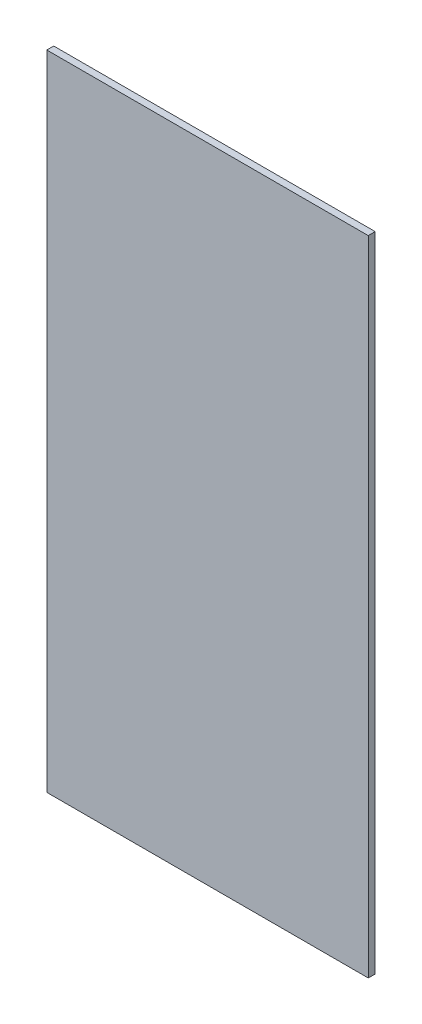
SolidWorks part; units mm, degrees
ref_plane "Front Plane" through (0, 0, 0) normal (0, 0, 1) x (1, 0, 0)
ref_plane "Top Plane" through (0, 0, 0) normal (0, 1, 0) x (1, 0, 0)
ref_plane "Right Plane" through (0, 0, 0) normal (1, 0, 0) x (0, 0, -1)
sketch "Sketch1" plane through (0, 0, 0) normal (0, 0, 1) x (1, 0, 0)
  line L1 (-290, 580) -> (290, 580)
  line L2 (-290, 580) -> (-290, -580)
  line L3 (-290, -580) -> (290, -580)
  line L4 (290, 580) -> (290, -580)
  point P4 (-290, 0)
  point P6 (0, 580)
  dimension "D1" = 580
  dimension "D2" = 1160
extrude "Boss-Extrude1" add sketch "Sketch1" along normal blind 25
sketch "Sketch3" plane through (0, 580, 0) normal (0, 1, 0) x (1, 0, 0)
  line L0 (-290, -12.5) -> (-321.8198, 19.3198)
  line L1 (-290, -12.5) -> (-258.1802, 19.3198)
  line L2 (-258.1802, 19.3198) -> (-321.8198, 19.3198)
  line L3 (-290, 0) -> (-290, -25) construction
  line L4 (-290, -25) -> (-290, 0) construction
  line L5 (290, 0) -> (-290, 0) construction
  line L6 (290, -25) -> (-290, -25) construction
  point P9 (-290, -12.5)
  dimension "D1" = 90
  dimension "D2" = 45
extrude "Cut-Extrude1" cut sketch "Sketch3" against normal up to surface (1160 mm away) contours L0 L2 L1
pattern_linear "LPattern1" count 5 spacing 145 along (0.7071, 0, 0.7071) of "Cut-Extrude1"
sketch "Sketch4" plane through (290, 0, 0) normal (1, 0, 0) x (0, 0, -1)
  line L0 (-12.5, 580) -> (48.5815, 641.0815)
  line L1 (-12.5, -580) -> (-12.5, 580) construction
  line L2 (48.5815, 641.0815) -> (48.5815, 518.9185)
  line L3 (48.5815, 518.9185) -> (-12.5, 580)
  line L4 (-25, 580) -> (-12.5, 580) construction
  dimension "D1" = 90
  dimension "D2" = 122.1629
extrude "Cut-Extrude2" cut sketch "Sketch4" against normal up to surface (580 mm away)
pattern_linear "LPattern2" count 9 spacing 145 along (0, -0.7071, 0.7071) of "Cut-Extrude2"
